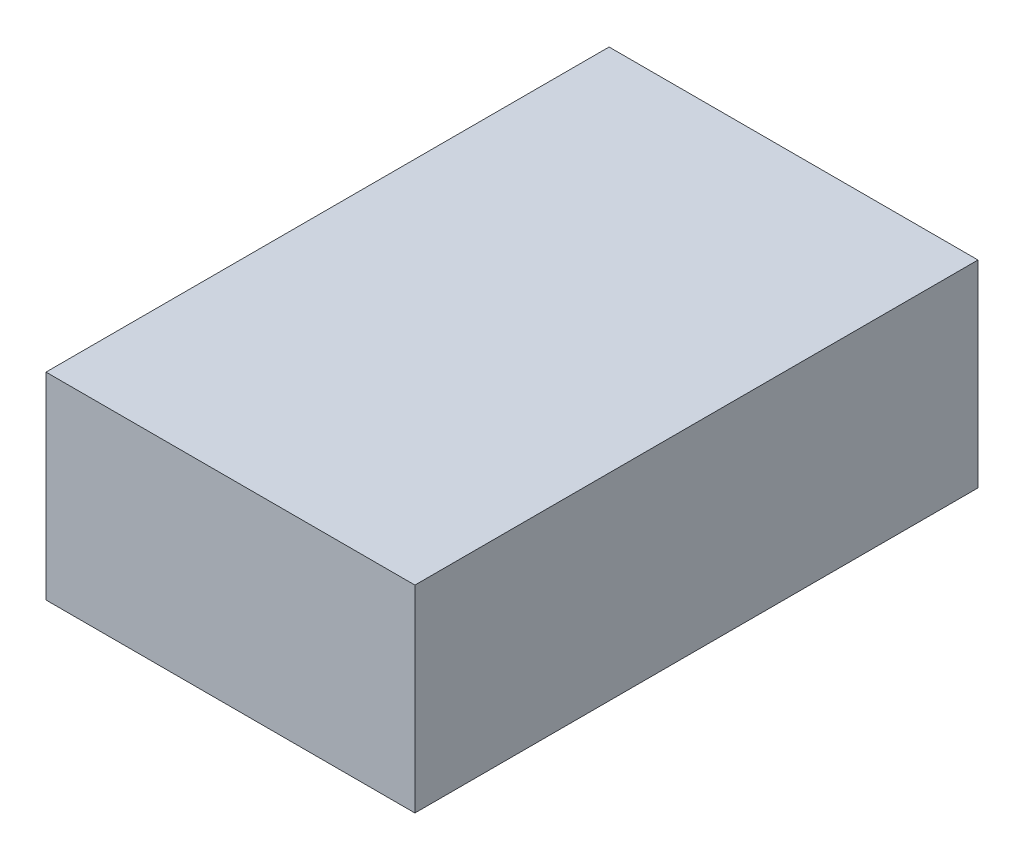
SolidWorks part; units mm, degrees
ref_plane "Front Plane" through (0, 0, 0) normal (0, 0, 1) x (1, 0, 0)
ref_plane "Top Plane" through (0, 0, 0) normal (0, 1, 0) x (1, 0, 0)
ref_plane "Right Plane" through (0, 0, 0) normal (1, 0, 0) x (0, 0, -1)
sketch "Sketch1" plane through (0, 0, 0) normal (0, 1, 0) x (1, 0, 0)
  line L1 (0, 0) -> (-57, 0)
  line L2 (0, 0) -> (0, 87)
  line L3 (0, 87) -> (-57, 87)
  line L4 (-57, 0) -> (-57, 87)
  dimension "D1" = 57
  dimension "D2" = 87
extrude "Boss-Extrude1" add sketch "Sketch1" along normal blind 30.5
